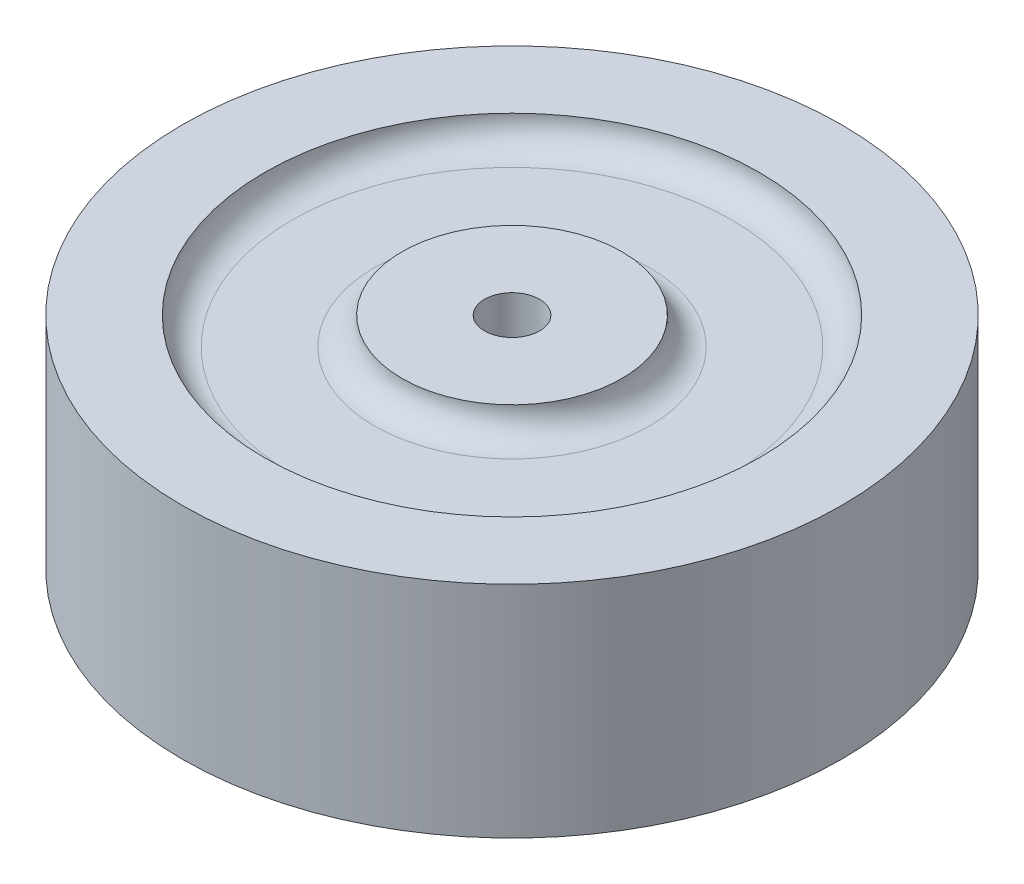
SolidWorks part; units mm, degrees
ref_plane "Front Plane" through (0, 0, 0) normal (0, 0, 1) x (1, 0, 0)
ref_plane "Top Plane" through (0, 0, 0) normal (0, 1, 0) x (1, 0, 0)
ref_plane "Right Plane" through (0, 0, 0) normal (1, 0, 0) x (0, 0, -1)
sketch "Sketch1" plane through (0, 0, 0) normal (0, 1, 0) x (1, 0, 0)
  circle A0 centre (0, 0) radius 38.1
  circle A2 centre (0, 0) radius 3.175
  dimension "D1" = 76.2
  dimension "D2" = 6.35
extrude "Boss-Extrude1" add sketch "Sketch1" along normal blind 19.05
sketch "Sketch2" plane through (0, 19.05, 0) normal (0, 1, 0) x (1, 0, 0)
  circle A0 centre (0, 0) radius 38.1
  circle A1 centre (0, 0) radius 28.575
  dimension "D1" = 57.15
  dimension "D2" = 76.2
extrude "Boss-Extrude2" add sketch "Sketch2" along normal blind 3.175
sketch "Sketch3" plane through (0, 0, 0) normal (0, -1, 0) x (1, 0, 0)
  circle A0 centre (0, 0) radius 38.1
  circle A1 centre (0, 0) radius 28.575
  dimension "D1" = 57.15
  dimension "D2" = 76.2
extrude "Boss-Extrude3" add sketch "Sketch3" along normal blind 3.175
sketch "Sketch4" plane through (0, 19.05, 0) normal (0, 1, 0) x (1, 0, 0)
  circle A0 centre (0, 0) radius 12.7
  circle A1 centre (0, 0) radius 3.175
  dimension "D1" = 25.4
  dimension "D2" = 6.35
extrude "Boss-Extrude4" add sketch "Sketch4" along normal blind 3.175
sketch "Sketch5" plane through (0, 0, 0) normal (0, -1, 0) x (1, 0, 0)
  circle A0 centre (0, 0) radius 3.175
  circle A1 centre (0, 0) radius 12.7
  dimension "D1" = 25.4
  dimension "D2" = 6.35
extrude "Boss-Extrude5" add sketch "Sketch5" along normal blind 3.175
fillet "Fillet1" radius 3.175 4 edges at (0, 19.05, 12.7) (0, 19.05, 28.575) (0, 0, -28.575) (0, 0, 12.7)
